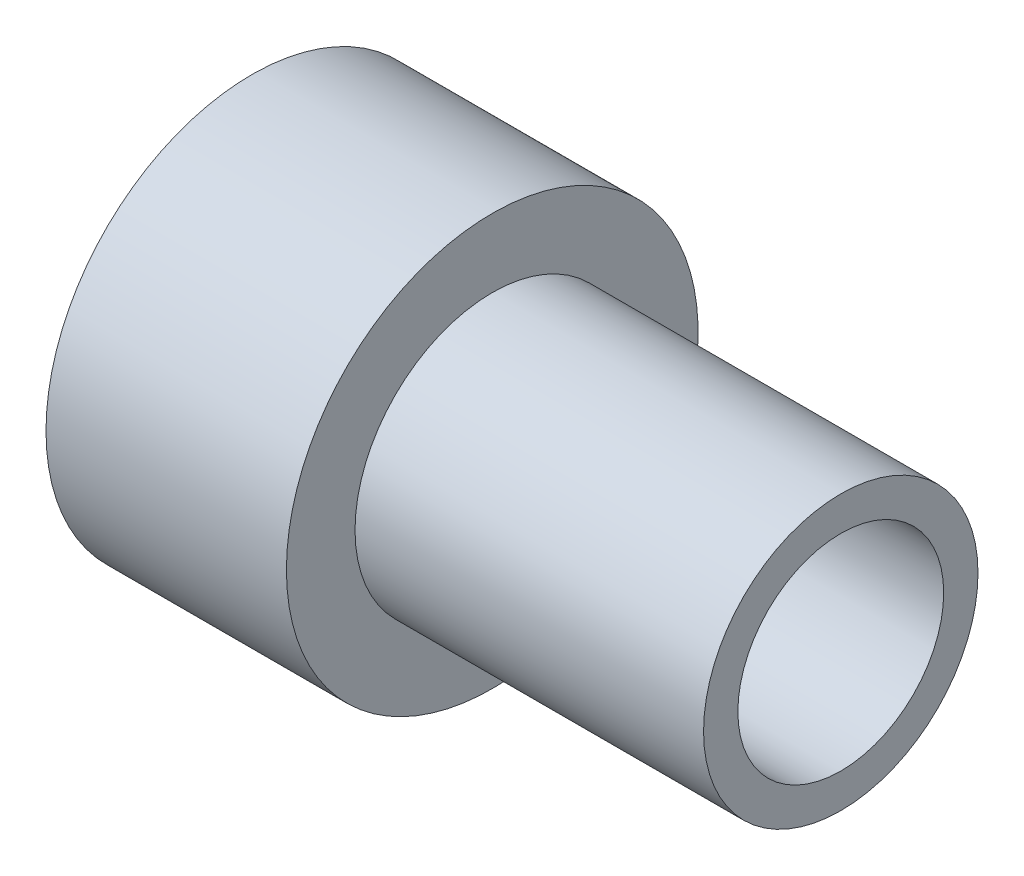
SolidWorks part; units mm, degrees
ref_plane "Front Plane" through (0, 0, 0) normal (0, 0, 1) x (1, 0, 0)
ref_plane "Top Plane" through (0, 0, 0) normal (0, 1, 0) x (1, 0, 0)
ref_plane "Right Plane" through (0, 0, 0) normal (1, 0, 0) x (0, 0, -1)
sketch "Sketch1" plane through (0, 0, 0) normal (0, 0, 1) x (1, 0, 0)
  line L0 (0, 0) -> (57.7933, 0) construction
  line L1 (0, 4.7625) -> (27.2542, 4.7625)
  line L2 (27.2542, 4.7625) -> (27.2542, 6.35)
  line L3 (27.2542, 6.35) -> (11.1252, 6.35)
  line L4 (11.1252, 6.35) -> (11.1252, 9.525)
  line L5 (11.1252, 9.525) -> (0, 9.525)
  line L6 (0, 9.525) -> (0, 4.7625)
  dimension "D1" = 9.525
  dimension "D2" = 12.7
  dimension "D3" = 11.1252
  dimension "D4" = 19.05
  dimension "D5" = 16.129
revolve "Revolve1" add sketch "Sketch1" angle 360 about L0
